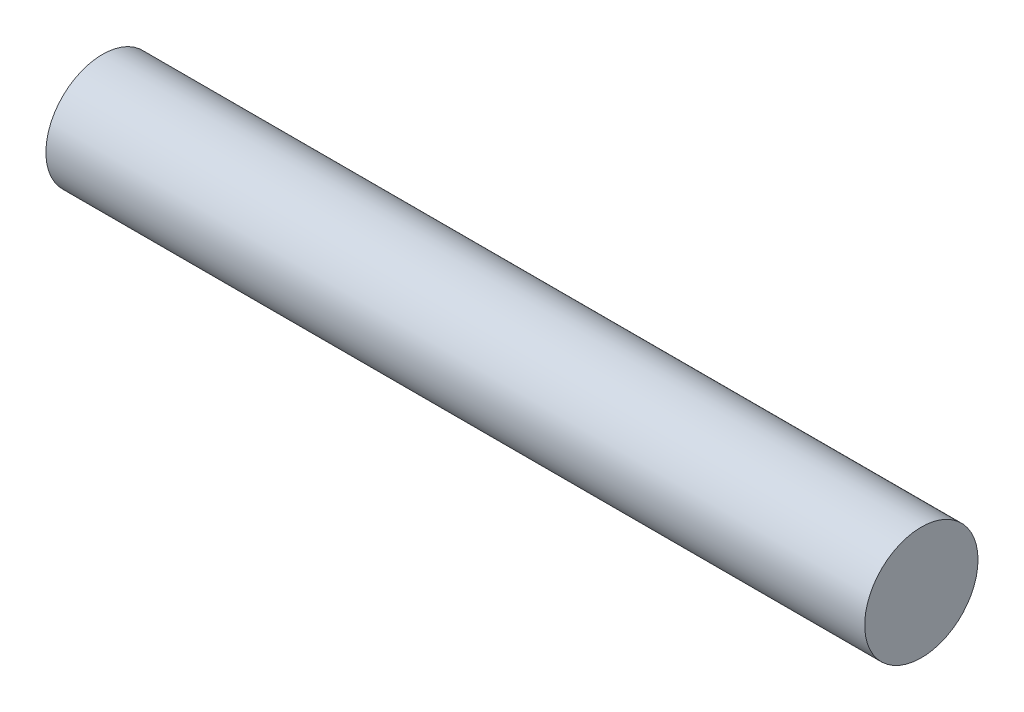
SolidWorks part; units mm, degrees
ref_plane "Спереди" through (0, 0, 0) normal (0, 0, 1) x (1, 0, 0)
ref_plane "Сверху" through (0, 0, 0) normal (0, 1, 0) x (1, 0, 0)
ref_plane "Справа" through (0, 0, 0) normal (1, 0, 0) x (0, 0, -1)
sketch "Эскиз1" plane through (0, 0, 0) normal (1, 0, 0) x (0, 0, -1)
  circle A0 centre (0, 0) radius 0.6502
  dimension "D1" = 1.3005
extrude "Бобышка-Вытянуть1" add sketch "Эскиз1" along normal mid plane 9.398
